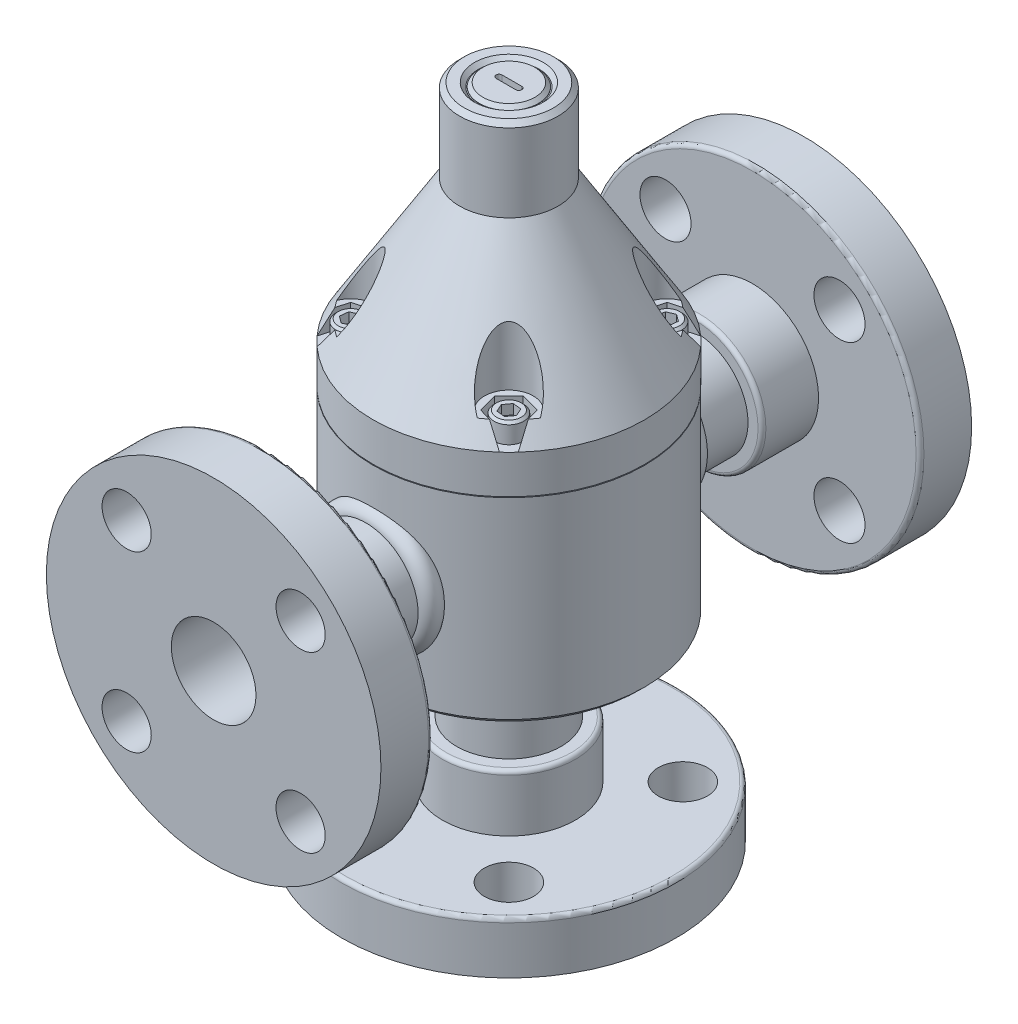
SolidWorks part; units mm, degrees
ref_plane "Front Plane" through (0, 0, 0) normal (0, 0, 1) x (1, 0, 0)
ref_plane "Top Plane" through (0, 0, 0) normal (0, 1, 0) x (1, 0, 0)
ref_plane "Right Plane" through (0, 0, 0) normal (1, 0, 0) x (0, 0, -1)
sketch "Sketch1" plane through (0, 0, 0) normal (0, 1, 0) x (1, 0, 0)
  circle A0 centre (0, 0) radius 43.815
  dimension "D1" = 87.63
extrude "Extrude1" add sketch "Sketch1" along normal blind 148.59
sketch "Sketch2" plane through (0, 0, 0) normal (0, 0, 1) x (1, 0, 0)
  line L0 (0, 148.59) -> (0, 0) construction
  line L1 (43.815, 148.59) -> (-43.815, 148.59) construction
  line L2 (-52.6288, 63.5) -> (-30.226, 63.5)
  line L4 (-30.226, 63.5) -> (-30.226, 63.754)
  line L5 (-30.226, 63.754) -> (-43.815, 63.754)
  line L7 (-43.815, 63.754) -> (-43.815, 76.2)
  line L8 (-43.815, 76.2) -> (-15.875, 121.92)
  line L9 (-15.875, 121.92) -> (-15.875, 152.4)
  line L10 (-15.875, 152.4) -> (-52.6288, 152.4)
  line L11 (-52.6288, 152.4) -> (-52.6288, 63.5)
  line L12 (-43.815, 0) -> (43.815, 0) construction
  dimension "D1" = 43.815
  dimension "D2" = 15.875
  dimension "D3" = 63.5
  dimension "D4" = 30.226
  dimension "D5" = 0.254
  dimension "D6" = 76.2
  dimension "D7" = 152.4
  dimension "D8" = 121.92
revolve "Cut-Revolve1" cut sketch "Sketch2" angle 360 about L0
chamfer "Chamfer1" distance 1.524 angle 45 2 edges at (0, 0, 43.815) (0, 148.59, 15.875)
ref_plane "Plane1" through (0, 148.59, 0) normal (0, 1, 0) x (-1, 0, 0)
sketch "Sketch3" plane through (0, 148.59, 0) normal (0, 1, 0) x (-1, 0, 0)
  circle A0 centre (0, 0) radius 11.1125
  dimension "D1" = 22.225
extrude "Extrude2" cut sketch "Sketch3" against normal blind 1.27 draft 45
sketch "Sketch4" plane through (0, 148.59, 0) normal (0, 1, 0) x (-1, 0, 0)
  circle A0 centre (0, 0) radius 9.525
  dimension "D1" = 19.05
extrude "Extrude3" add sketch "Sketch4" against normal up to surface (1.27 mm away)
chamfer "Chamfer2" distance 1.143 angle 45 1 edges at (0, 148.59, 9.525)
sketch "Sketch5" plane through (0, 148.59, 0) normal (0, 1, 0) x (-1, 0, 0)
  line L0 (3.175, 0) -> (-3.175, 0) construction
  line L1 (3.175, 0.9652) -> (-3.175, 0.9652)
  line L2 (-3.175, -0.9652) -> (3.175, -0.9652)
  arc A0 (-3.175, 0.9652) -> (-3.175, -0.9652) centre (-3.175, 0) ccw
  arc A1 (3.175, -0.9652) -> (3.175, 0.9652) centre (3.175, 0) ccw
  dimension "D1" = 3.175
  dimension "D2" = 6.35
  dimension "D3" = 0.9652
  dimension "D4" = 0.9652
extrude "Extrude4" cut sketch "Sketch5" against normal blind 3.175 draft 1
ref_plane "Plane2" through (0, 82.55, 0) normal (0, 1, 0) x (-1, 0, 0)
sketch "Sketch6" plane through (0, 82.55, 0) normal (0, 1, 0) x (-1, 0, 0)
  line L0 (0, 0) -> (-30.9819, 30.9819) construction
  circle A0 centre (0, 0) radius 36.0934 construction
  circle A1 centre (0, 0) radius 43.815 construction
  circle A2 centre (-25.5219, 25.5219) radius 7.874
  dimension "D1" = 15.748
extrude "Extrude5" cut sketch "Sketch6" along normal blind 22.86
sketch "Sketch7" plane through (0, 82.55, 0) normal (0, 1, 0) x (-1, 0, 0)
  line L0 (0, 0) -> (-25.5219, 25.5219) construction
  line L1 (-25.5219, 25.5219) -> (-31.0896, 19.9541) construction
  line L2 (-25.5219, 25.5219) -> (-19.9541, 31.0896) construction
  line L3 (-25.5219, 25.5219) -> (-39.3911, 39.3911) construction
  line L4 (-30.0845, 20.9593) -> (-23.8519, 19.2893)
  line L5 (-23.8519, 19.2893) -> (-19.2893, 23.8519)
  line L6 (-19.2893, 23.8519) -> (-20.9593, 30.0845)
  line L10 (-30.0845, 20.9593) -> (-33.6536, 33.6536)
  line L11 (-33.6536, 33.6536) -> (-20.9593, 30.0845)
  line L13 (-27.1919, 31.7545) -> (-31.7545, 27.1919)
  line L14 (-20.9593, 30.0845) -> (-27.1919, 31.7545)
  line L15 (-31.7545, 27.1919) -> (-30.0845, 20.9593)
  arc A0 (-32.8666, 22.6837) -> (-22.6837, 32.8666) centre (-25.5219, 25.5219) ccw construction
  circle A1 centre (-25.5219, 25.5219) radius 5.588 construction
extrude "Extrude6" cut sketch "Sketch7" against normal blind 6.35
sketch "Sketch8" plane through (0, 82.55, 0) normal (0, 1, 0) x (-1, 0, 0)
  circle A0 centre (-25.5219, 25.5219) radius 4.7625
  dimension "D1" = 9.525
extrude "Extrude7" add sketch "Sketch8" against normal up to surface (6.35 mm away)
sketch "Sketch9" plane through (0, 82.55, 0) normal (0, 1, 0) x (-1, 0, 0)
  line L1 (-23.8739, 27.7452) -> (-26.6233, 28.0608)
  line L2 (-26.6233, 28.0608) -> (-28.2713, 25.8375)
  line L3 (-28.2713, 25.8375) -> (-27.1699, 23.2986)
  line L4 (-27.1699, 23.2986) -> (-24.4205, 22.983)
  line L5 (-24.4205, 22.983) -> (-22.7725, 25.2063)
  line L6 (-22.7725, 25.2063) -> (-23.8739, 27.7452)
  circle A0 centre (-25.5219, 25.5219) radius 2.3967 construction
extrude "Extrude8" cut sketch "Sketch9" against normal blind 3.175
pattern_circular "CirPattern1" count 4 over 360 about axis through (0, 0, 0) along (0, 1, 0) of "Extrude5", "Extrude6", "Extrude7", "Extrude8"
chamfer "Chamfer3" distance 0.762 angle 45 4 edges at (25.5219, 82.55, 30.2844) (30.2844, 82.55, -25.5219) (-25.5219, 82.55, -30.2844) (-30.2844, 82.55, 25.5219)
ref_plane "Plane3" through (0, 0, 95.25) normal (0, 0, 1) x (1, 0, 0)
sketch "Sketch10" plane through (0, 0, 95.25) normal (0, 0, 1) x (1, 0, 0)
  line L0 (0, 0) -> (0, 148.59) construction
  line L2 (-3.175, 148.59) -> (3.175, 148.59) construction
  line L3 (43.815, 31.75) -> (-43.815, 31.75) construction
  line L4 (43.815, 1.524) -> (43.815, 63.5) construction
  line L5 (-43.815, 63.5) -> (-43.815, 1.524) construction
  line L6 (-42.291, 0) -> (42.291, 0) construction
  circle A0 centre (0, 31.75) radius 53.975
  dimension "D2" = 107.95
  dimension "D1" = 31.75
extrude "Boss-Extrude1" add sketch "Sketch10" against normal blind 16.6624 separate body
sketch "Sketch11" plane through (0, 0, 95.25) normal (0, 0, 1) x (1, 0, 0)
  circle A0 centre (0, 31.75) radius 21.4249
  dimension "D1" = 42.8498
extrude "Boss-Extrude2" add sketch "Sketch11" against normal blind 34.925
sketch "Sketch12" plane through (0, 0, 95.25) normal (0, 0, 1) x (1, 0, 0)
  circle A0 centre (0, 31.75) radius 16.8275
  dimension "D1" = 33.655
extrude "Boss-Extrude3" add sketch "Sketch12" against normal up to surface (54.7952 mm away)
sketch "Sketch13" plane through (0, 0, 95.25) normal (0, 0, 1) x (1, 0, 0)
  line L0 (0, 31.75) -> (-53.975, 31.75) construction
  line L1 (0, 31.75) -> (-38.1661, 69.9161) construction
  circle A0 centre (0, 31.75) radius 53.975 construction
  circle A1 centre (0, 31.75) radius 39.6875 construction
  circle A2 centre (-28.0633, 59.8133) radius 7.9375
  dimension "D2" = 79.375
  dimension "D3" = 15.875
  dimension "D1" = 45
extrude "Cut-Extrude1" cut sketch "Sketch13" against normal blind 34.925
pattern_circular "CirPattern3" count 4 over 360 about axis through (0, 31.75, 0) along (0, 0, 1) of "Cut-Extrude1"
sketch "Sketch14" plane through (0, 0, 95.25) normal (0, 0, 1) x (1, 0, 0)
  circle A0 centre (0, 31.75) radius 13.6525
  dimension "D1" = 27.305
extrude "Cut-Extrude2" cut sketch "Sketch14" against normal blind 25.4
ref_plane "Plane4" through (0, 0, -95.25) normal (0, 0, 1) x (1, 0, 0)
sketch "Sketch15" plane through (0, 0, -95.25) normal (0, 0, 1) x (1, 0, 0)
  circle A0 centre (0, 31.75) radius 54.0468
extrude "Boss-Extrude4" add sketch "Sketch15" along normal blind 16.6624 separate body
sketch "Sketch16" plane through (0, 0, -95.25) normal (0, 0, 1) x (1, 0, 0)
  circle A0 centre (0, 31.75) radius 21.3232
extrude "Boss-Extrude5" add sketch "Sketch16" along normal blind 34.925
sketch "Sketch17" plane through (0, 0, -95.25) normal (0, 0, 1) x (1, 0, 0)
  circle A0 centre (0, 31.75) radius 16.8275
extrude "Boss-Extrude6" add sketch "Sketch17" along normal up to surface (54.7952 mm away)
sketch "Sketch18" plane through (0, 0, -95.25) normal (0, 0, 1) x (1, 0, 0)
  circle A0 centre (28.0633, 59.8133) radius 8.2369
extrude "Cut-Extrude3" cut sketch "Sketch18" along normal blind 34.925
pattern_circular "CirPattern4" count 4 over 360 about axis through (0, 31.75, 0) along (0, 0, 1) of "Cut-Extrude3"
fillet "Fillet1" radius 1.27 4 edges at (54.0468, 31.75, -78.5876) (21.3232, 31.75, -60.325) (21.4249, 31.75, 60.325) (53.975, 31.75, 78.5876)
sketch "Sketch19" plane through (0, 0, 0) normal (1, 0, 0) x (0, 0, -1)
  line L0 (-46.147, 46.3279) -> (-46.147, 48.2109)
  line L2 (-38.7005, 48.5533) -> (-38.7005, 44.2737)
  line L3 (-38.7005, 44.2737) -> (-46.147, 46.3279)
  line L4 (-59.3637, 31.8439) -> (0, 31.8439) construction
  arc A0 (-46.147, 48.2109) -> (-38.7005, 48.5533) centre (-42.4159, 48.2109) cw
revolve "Revolve1" add sketch "Sketch19" angle 360 about L4
mirror "Mirror2" about plane through (0, 0, 0) normal (0, 0, 1) of "Revolve1"
ref_plane "Plane5" through (0, -63.5, 0) normal (0, 1, 0) x (1, 0, 0)
sketch "Sketch20" plane through (0, -63.5, 0) normal (0, 1, 0) x (1, 0, 0)
  circle A0 centre (0, 0) radius 53.975
  dimension "D1" = 107.95
extrude "Boss-Extrude7" add sketch "Sketch20" along normal blind 16.6624 separate body
sketch "Sketch21" plane through (0, -63.5, 0) normal (0, 1, 0) x (1, 0, 0)
  circle A0 centre (0, 0) radius 21.463
  dimension "D1" = 42.926
extrude "Boss-Extrude8" add sketch "Sketch21" along normal blind 34.925
sketch "Sketch22" plane through (0, -63.5, 0) normal (0, 1, 0) x (1, 0, 0)
  circle A0 centre (0, 0) radius 16.8275
  dimension "D1" = 33.655
extrude "Boss-Extrude9" add sketch "Sketch22" along normal up to surface (63.5 mm away)
fillet "Fillet2" radius 1.27 2 edges at (0, -46.8376, 53.975) (0, -28.575, 21.463)
sketch "Sketch23" plane through (0, -63.5, 0) normal (0, 1, 0) x (1, 0, 0)
  circle A0 centre (0, 0) radius 13.6525
  dimension "D1" = 27.305
extrude "Cut-Extrude4" cut sketch "Sketch23" along normal blind 25.4
sketch "Sketch24" plane through (0, -63.5, 0) normal (0, 1, 0) x (1, 0, 0)
  line L0 (0, 0) -> (-53.975, 0) construction
  line L1 (0, 0) -> (-38.1661, -38.1661) construction
  circle A0 centre (0, 0) radius 53.975 construction
  circle A4 centre (0, 0) radius 39.6875 construction
  circle A5 centre (-28.0633, -28.0633) radius 7.9375
  dimension "D2" = 79.375
  dimension "D3" = 15.875
  dimension "D1" = 45
extrude "Cut-Extrude5" cut sketch "Sketch24" along normal blind 25.4
pattern_circular "CirPattern5" count 4 over 360 about axis through (0, 0, 0) along (0, 1, 0) of "Cut-Extrude5"
sketch "Sketch25" plane through (0, 0, 0) normal (1, 0, 0) x (0, 0, -1)
  line L0 (0, 0) -> (0, -28.575) construction
  line L1 (-42.291, 0) -> (42.291, 0) construction
  line L2 (16.8275, -28.575) -> (-16.8275, -28.575) construction
  line L3 (-20.0025, 1.7004) -> (-20.0025, 4.8882)
  line L4 (-20.0025, 4.8882) -> (-14.145, 4.8882)
  line L5 (-14.145, 4.8882) -> (-14.145, -3.175)
  line L6 (-16.8275, 0) -> (-16.8275, -28.575) construction
  arc A0 (-14.145, -3.175) -> (-20.0025, 1.7004) centre (-15.1832, 1.5341) cw
  dimension "D1" = 3.175
  dimension "D2" = 3.175
revolve "Revolve2" add sketch "Sketch25" angle 360 about L0
